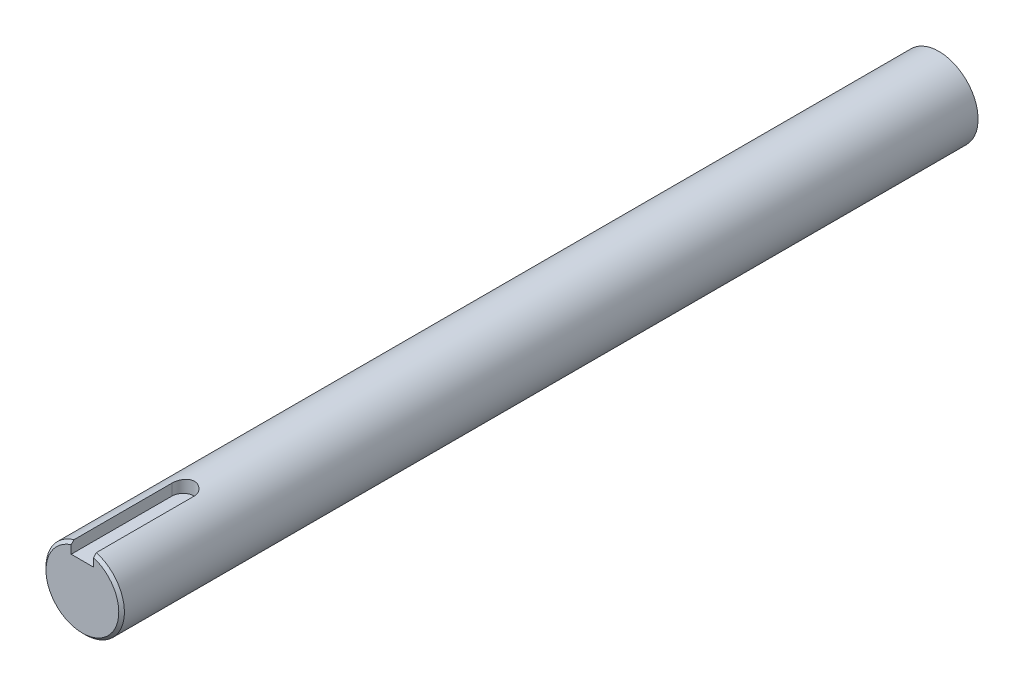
SolidWorks part; units mm, degrees
ref_plane "前视基准面" through (0, 0, 0) normal (0, 0, 1) x (1, 0, 0)
ref_plane "上视基准面" through (0, 0, 0) normal (0, 1, 0) x (1, 0, 0)
ref_plane "右视基准面" through (0, 0, 0) normal (1, 0, 0) x (0, 0, -1)
sketch "草图1" plane through (0, 0, 0) normal (0, 0, 1) x (1, 0, 0)
  line L0 (2, 4.7) -> (-2, 4.7)
  line L1 (0, 11.0283) -> (0, -13.3285) construction
  line L3 (2, 4.7) -> (2, 6.7082)
  line L4 (-2, 4.7) -> (-2, 6.7082)
  arc A0 (-2, 6.7082) -> (2, 6.7082) centre (0, 0) ccw
  dimension "D1" = 14
  dimension "D2" = 4.7
extrude "凸台-拉伸1" add sketch "草图1" along normal blind 98
sketch "草图2" plane through (0, 0, 0) normal (0, 0, -1) x (-1, 0, 0)
  circle A0 centre (0, 0) radius 7
  dimension "D1" = 14
extrude "凸台-拉伸4" add sketch "草图2" against normal blind 80
sketch "草图6" plane through (0, 4.7, 0) normal (0, 1, 0) x (1, 0, 0)
  line L0 (-2, -80) -> (-2, -98) construction
  line L1 (-2, -80) -> (2, -80)
  arc A0 (2, -80) -> (-2, -80) centre (0, -80) ccw
extrude "切除-拉伸20" cut sketch "草图6" along normal blind 80
chamfer "倒角1" distance 0.5 angle 45 1 edges at (0, -7, 98)
sketch "草图7" plane through (0, 0, 0) normal (0, 0, -1) x (-1, 0, 0)
  circle A1 centre (0, 0) radius 7
  circle A2 centre (0, 0) radius 7
  dimension "D1" = 0
extrude "凸台-拉伸5" add sketch "草图7" along normal blind 55
